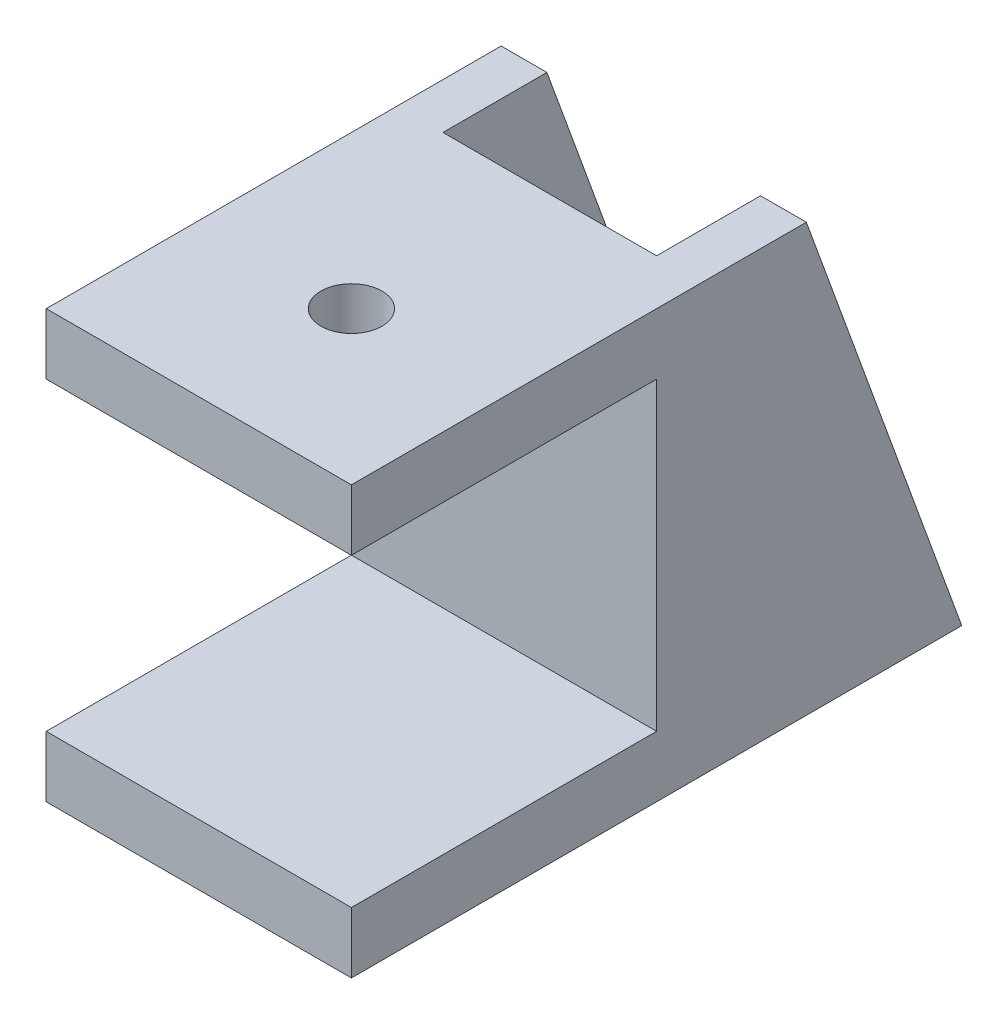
SolidWorks part; units mm, degrees
ref_plane "Alzado" through (0, 0, 0) normal (0, 0, 1) x (1, 0, 0)
ref_plane "Planta" through (0, 0, 0) normal (0, 1, 0) x (1, 0, 0)
ref_plane "Vista lateral" through (0, 0, 0) normal (1, 0, 0) x (0, 0, -1)
sketch "Sketch7" plane through (0, 0, 0) normal (1, 0, 0) x (0, 0, -1)
  line L0 (-29.8125, 23.99) -> (-29.8125, 19.99)
  line L1 (-29.8125, 19.99) -> (-9.8125, 19.99)
  line L2 (-9.8125, 19.99) -> (-9.8125, 0)
  line L3 (-9.8125, 0) -> (-29.8125, 0)
  line L4 (-29.8125, 0) -> (-29.8125, -4)
  line L5 (-29.8125, -4) -> (10.1875, -4)
  line L6 (10.1875, -4) -> (0, 23.99)
  line L7 (0, 23.99) -> (-29.8125, 23.99)
  line L8 (0, 0) -> (87.8092, 0) construction
  line L10 (0, -46.3065) -> (0, 45.8278) construction
  line L11 (-39.8125, -4) -> (-39.8125, 23.99) construction
  line L12 (-39.8125, 23.99) -> (-29.8125, 23.99) construction
  line L13 (-29.8125, -4) -> (-39.8125, -4) construction
  line L14 (-29.8125, 0) -> (-29.8125, 19.99) construction
  dimension "D1" = 4
  dimension "D2" = 19.99
  dimension "D3" = 4
  dimension "D4" = 20
  dimension "D5" = 70
  dimension "D6" = 20
  dimension "D7" = 10
extrude "Boss-Extrude3" add sketch "Sketch7" along normal blind 20
sketch "Sketch13" plane through (0, 23.99, 0) normal (0, 1, 0) x (1, 0, 0)
  line L0 (10, 0) -> (10, -29.8125) construction
  line L1 (20, 0) -> (0, 0) construction
  line L2 (20, -29.8125) -> (0, -29.8125) construction
  line L4 (20, 0) -> (20, -29.8125) construction
  line L6 (0, 0) -> (0, -29.8125) construction
  line L7 (0, -9.8125) -> (20, -9.8125) construction
  line L8 (0, -19.8125) -> (20, -19.8125) construction
  circle A0 centre (10, -19.8125) radius 2
  dimension "D3" = 4
  dimension "D1" = 20
  dimension "D2" = 10
extrude "Cut-Extrude4" cut sketch "Sketch13" against normal blind 5
sketch "Sketch15" plane through (0, 23.99, 0) normal (0, 1, 0) x (1, 0, 0)
  line L0 (3, 10.1875) -> (3, -6.8125)
  line L1 (20, 10.1875) -> (0, 10.1875) construction
  line L3 (17, -6.8125) -> (17, 10.1875)
  line L4 (17, 10.1875) -> (3, 10.1875)
  line L5 (0, 10.1875) -> (0, 0) construction
  line L9 (3, -6.8125) -> (17, -6.8125)
  line L10 (20, -29.8125) -> (0, -29.8125) construction
  dimension "D1" = 14
  dimension "D2" = 3
  dimension "D3" = 23
extrude "Cut-Extrude6" cut sketch "Sketch15" against normal blind 22
sketch "Sketch16" plane through (0, 1.99, 0) normal (0, 1, 0) x (1, 0, 0)
  line L0 (10, 4.5073) -> (10, -3.3125) construction
  line L1 (13.1, 4.5073) -> (13.1, -3.3125)
  line L2 (6.9, 4.5073) -> (6.9, -3.3125)
  line L4 (17, -6.8125) -> (17, 8.0073) construction
  line L5 (3, -6.8125) -> (17, -6.8125) construction
  line L6 (17, 8.0073) -> (3, 8.0073) construction
  line L7 (10, -29.8125) -> (10, 10.1875) construction
  line L8 (20, -29.8125) -> (0, -29.8125) construction
  line L9 (20, 10.1875) -> (0, 10.1875) construction
  arc A0 (13.1, 4.5073) -> (6.9, 4.5073) centre (10, 4.5073) ccw
  arc A1 (6.9, -3.3125) -> (13.1, -3.3125) centre (10, -3.3125) ccw
  point P2 (10, 0.5974)
  dimension "D4" = 3.5
  dimension "D1" = 6.2
  dimension "D3" = 3.9
  dimension "D5" = 3.5
extrude "Cut-Extrude7" cut sketch "Sketch16" against normal blind 20
